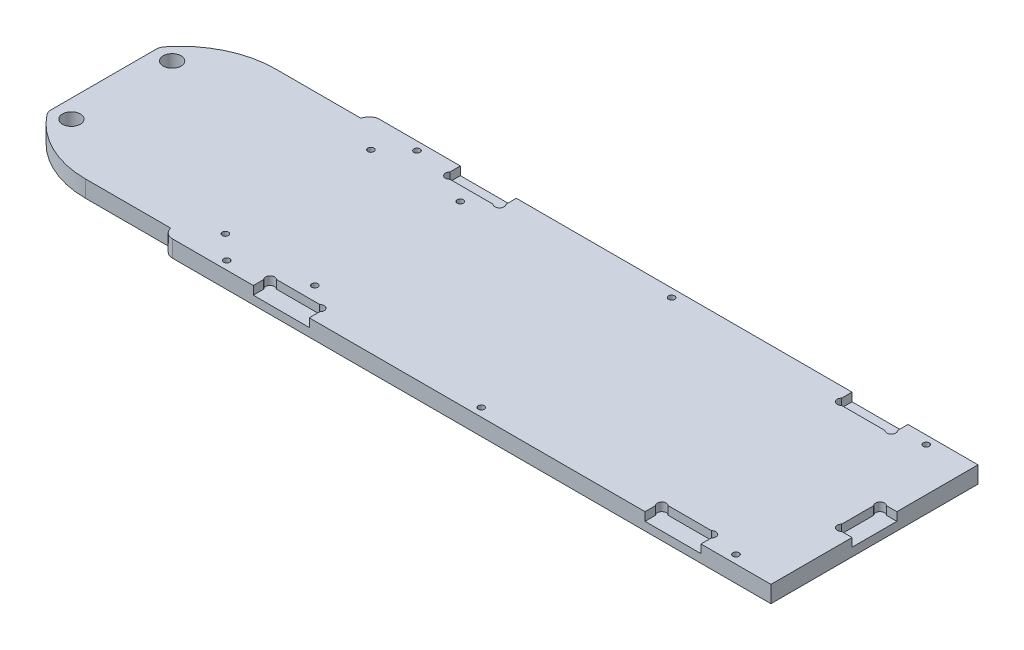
SolidWorks part; units mm, degrees
ref_plane "Plan de face" through (0, 0, 0) normal (0, 0, 1) x (1, 0, 0)
ref_plane "Plan de dessus" through (0, 0, 0) normal (0, 1, 0) x (1, 0, 0)
ref_plane "Plan de droite" through (0, 0, 0) normal (1, 0, 0) x (0, 0, -1)
sketch "Esquisse1" plane through (0, 0, 0) normal (0, 1, 0) x (1, 0, 0)
  line L0 (-80.6205, 0) -> (197.8528, 0) construction
  line L1 (0, -20.6939) -> (0, 96.124) construction
  line L2 (-80.6205, 74) -> (197.8528, 74) construction
  line L3 (210, -6.4016) -> (210, 96.124) construction
  line L4 (103.5, 88.2841) -> (103.5, 28.1424) construction
  line L5 (-72.2381, 37) -> (104.1811, 37) construction
  line L6 (-38, 71) -> (-7.5, 71)
  line L7 (-3.8668, 74) -> (210, 74)
  line L8 (-7.5, 82.6293) -> (-7.5, -13.5506) construction
  line L9 (-3.8668, 0) -> (210, 0)
  line L10 (210, 74) -> (210, 0)
  line L11 (12.5, 82.6293) -> (12.5, 30.6537) construction
  line L12 (-42.2549, 63) -> (75.355, 63) construction
  line L13 (4, -13.5506) -> (4, 67.8324) construction
  line L14 (20, -20.6939) -> (20, 48.6985) construction
  line L15 (-65.5, 56.9937) -> (-65.5, 17.0063)
  line L16 (-38, 3) -> (-7.5, 3)
  line L23 (-59, 27.9132) -> (-59, 60.8334) construction
  line L24 (-42.2549, 55) -> (-59, 55) construction
  line L25 (-38, 96.124) -> (-38, -3.1392) construction
  circle A0 centre (12.5, 71) radius 1.1
  circle A1 centre (194.5, 71) radius 1.1
  circle A2 centre (103.5, 71) radius 1.1
  circle A3 centre (103.5, 3) radius 1.1
  circle A4 centre (194.5, 3) radius 1.1
  circle A5 centre (12.5, 3) radius 1.1
  circle A6 centre (4, 63) radius 1.1
  circle A7 centre (36, 63) radius 1.1
  circle A8 centre (36, 11) radius 1.1
  circle A9 centre (4, 11) radius 1.1
  arc A10 (-65.5, 17.0063) -> (-38, 3) centre (-38, 37) ccw
  arc A11 (-38, 71) -> (-65.5, 56.9937) centre (-38, 37) ccw
  arc A12 (-3.8668, 74) -> (-7.5, 71) centre (-3.8668, 70.3) ccw
  arc A13 (-3.8668, 0) -> (-7.5, 3) centre (-3.8668, 3.7) cw
  circle A14 centre (-59, 55) radius 3.2
  circle A15 centre (-59, 19) radius 3.2
  dimension "D7" = 26
  dimension "D10" = 59
  dimension "D13" = 7.5
  dimension "D2" = 65.5
  dimension "D1" = 210
  dimension "D3" = 103.5
  dimension "D4" = 37
  dimension "D6" = 12.5
  dimension "D8" = 4
  dimension "D9" = 20
  dimension "D11" = 38
  dimension "D12" = 18
extrude "Boss.-Extru.1" add sketch "Esquisse1" along normal blind 6
sketch "Esquisse2" plane through (0, 6, 0) normal (0, 1, 0) x (1, 0, 0)
  line L0 (-10.7783, 37) -> (0, 37) construction
  line L1 (35, 52.4426) -> (35, 32.5302) construction
  line L2 (25, 47.0159) -> (25, 31.3774) construction
  line L4 (-8.2529, 68) -> (60.3234, 68) construction
  line L5 (25, 68) -> (38.3086, 81.3086) construction
  line L6 (210, 74) -> (-3.8668, 74) construction
  line L7 (27.2627, 68) -> (42.7373, 68)
  line L8 (25, 70.2627) -> (25, 74)
  line L9 (25, 74) -> (45, 74)
  line L10 (45, 70.2627) -> (45, 74)
  line L11 (105, 99.2475) -> (105, 34) construction
  line L12 (165, 70.2627) -> (165, 74)
  line L13 (182.7373, 68) -> (167.2627, 68)
  line L14 (185, 70.2627) -> (185, 74)
  line L15 (165, 74) -> (185, 74)
  line L16 (165, 0) -> (185, 0)
  line L17 (185, 3.7373) -> (185, 0)
  line L18 (182.7373, 6) -> (167.2627, 6)
  line L19 (165, 3.7373) -> (165, 0)
  line L20 (45, 3.7373) -> (45, 0)
  line L21 (25, 0) -> (45, 0)
  line L22 (25, 3.7373) -> (25, 0)
  line L23 (27.2627, 6) -> (42.7373, 6)
  line L24 (210, 37) -> (211.612, 37) construction
  line L25 (210, 0) -> (210, 74) construction
  line L26 (181.2288, 45) -> (205.9054, 45) construction
  line L27 (204, 47.3086) -> (204, 3.7373) construction
  line L28 (204, 45) -> (222.5802, 26.4198) construction
  line L29 (204, 42.7373) -> (204, 31.2627)
  line L30 (206.2627, 29) -> (210, 29)
  line L31 (210, 29) -> (210, 45)
  line L32 (206.2627, 45) -> (210, 45)
  line L33 (0, -6.5236) -> (0, 100.4437) construction
  line L34 (35, 92.7543) -> (35, 58.5795) construction
  arc A0 (25, 70.2627) -> (27.2627, 68) centre (26.1314, 69.1314) ccw
  arc A1 (45, 70.2627) -> (42.7373, 68) centre (43.8686, 69.1314) cw
  arc A2 (165, 70.2627) -> (167.2627, 68) centre (166.1314, 69.1314) ccw
  arc A3 (185, 70.2627) -> (182.7373, 68) centre (183.8686, 69.1314) cw
  arc A4 (185, 3.7373) -> (182.7373, 6) centre (183.8686, 4.8686) ccw
  arc A5 (165, 3.7373) -> (167.2627, 6) centre (166.1314, 4.8686) cw
  arc A6 (45, 3.7373) -> (42.7373, 6) centre (43.8686, 4.8686) ccw
  arc A7 (25, 3.7373) -> (27.2627, 6) centre (26.1314, 4.8686) cw
  arc A8 (206.2627, 45) -> (204, 42.7373) centre (205.1314, 43.8686) ccw
  arc A9 (206.2627, 29) -> (204, 31.2627) centre (205.1314, 30.1314) cw
  dimension "D5" = 105
  dimension "D1" = 6
  dimension "D2" = 35
  dimension "D3" = 10
  dimension "D4" = 45
  dimension "D6" = 6
  dimension "D7" = 8
  dimension "D8" = 45
extrude "Enlèv. mat.-Extru.1" cut sketch "Esquisse2" against normal blind 3
fillet "Congé2" radius 3.7 2 edges at (-65.5, 3, -17.0063) (-65.5, 3, -56.9937)
